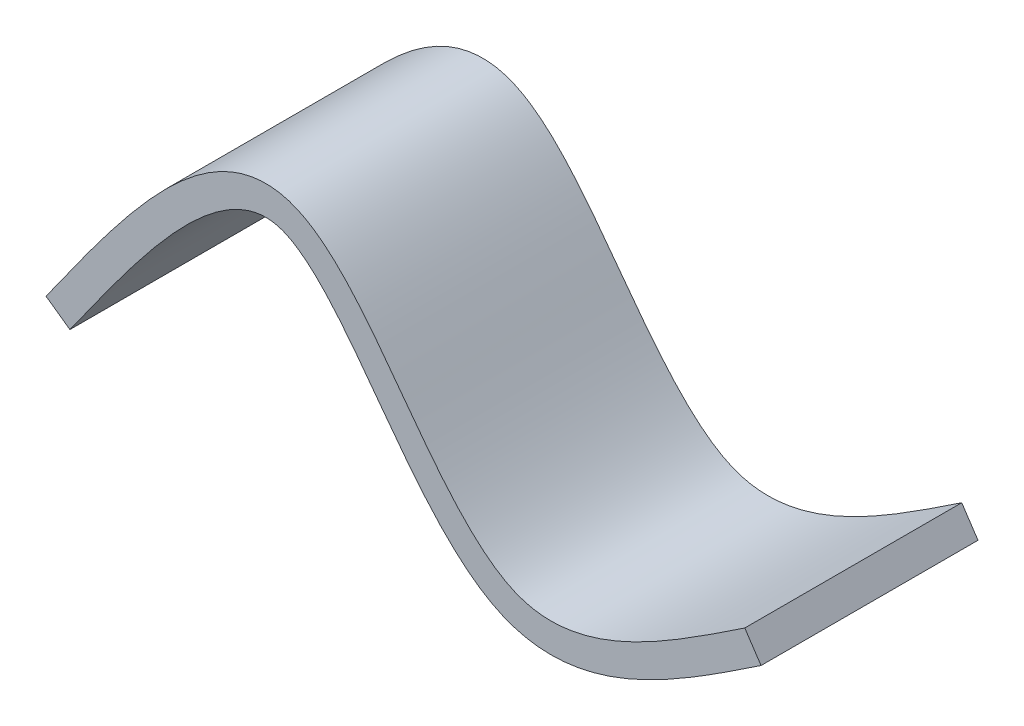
SolidWorks part; units mm, degrees
ref_plane "Front" through (0, 0, 0) normal (0, 0, 1) x (1, 0, 0)
ref_plane "Top" through (0, 0, 0) normal (0, 1, 0) x (1, 0, 0)
ref_plane "Right" through (0, 0, 0) normal (1, 0, 0) x (0, 0, -1)
sketch "Sketch1" plane through (0, 0, 0) normal (0, 0, 1) x (1, 0, 0)
  spline_without_curve S0
surface "Surface-Extrude1" sketch "Sketch1" parameters "D1"=74
thicken "Thicken1" surfaces to thicken 101 thickness 5 thickness side both sides parameters "D1"=5
